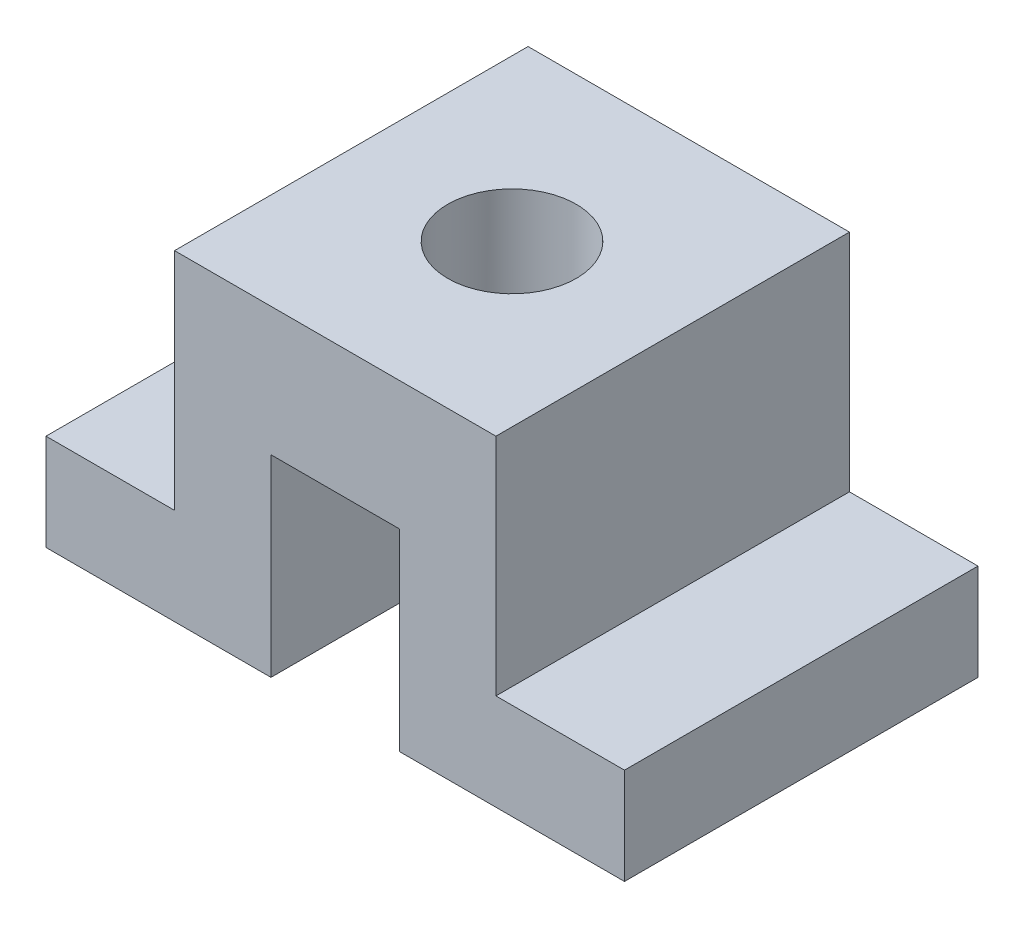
SolidWorks part; units mm, degrees
ref_plane "前视基准面" through (0, 0, 0) normal (0, 0, 1) x (1, 0, 0)
ref_plane "上视基准面" through (0, 0, 0) normal (0, 1, 0) x (1, 0, 0)
ref_plane "右视基准面" through (0, 0, 0) normal (1, 0, 0) x (0, 0, -1)
sketch "草图1" plane through (0, 0, 0) normal (0, 1, 0) x (1, 0, 0)
  line L1 (0, 0) -> (90, 0)
  line L2 (0, 0) -> (0, 55)
  line L3 (0, 55) -> (90, 55)
  line L4 (90, 0) -> (90, 55)
  dimension "D1" = 90
  dimension "D2" = 55
extrude "拉伸1" add sketch "草图1" along normal blind 50
sketch "草图3" plane through (0, 0, 0) normal (0, 0, 1) x (1, 0, 0)
  line L0 (0, 0) -> (90, 0) construction
  line L1 (0, 50) -> (20, 50)
  line L2 (0, 50) -> (0, 15)
  line L3 (0, 15) -> (20, 15)
  line L4 (20, 50) -> (20, 15)
  line L5 (90, 50) -> (70, 50)
  line L6 (90, 50) -> (90, 15)
  line L7 (90, 15) -> (70, 15)
  line L8 (70, 50) -> (70, 15)
  line L9 (35, 0) -> (55, 0)
  line L10 (35, 0) -> (35, 30)
  line L11 (35, 30) -> (55, 30)
  line L12 (55, 0) -> (55, 30)
  line L13 (45, 0) -> (45, -11.1635) construction
  dimension "D1" = 20
  dimension "D2" = 20
  dimension "D3" = 30
  dimension "D4" = 20
  dimension "D5" = 15
extrude "切除-拉伸1" cut sketch "草图3" against normal through all
sketch "草图4" plane through (0, 50, 0) normal (0, 1, 0) x (1, 0, 0)
  line L0 (20, 27.5) -> (56.2069, 27.5) construction
  line L1 (20, 55) -> (20, 0) construction
  line L2 (45, 55) -> (45, 18.8793) construction
  line L3 (70, 55) -> (20, 55) construction
  circle A0 centre (45, 27.5) radius 10
  dimension "D1" = 20
extrude "切除-拉伸2" cut sketch "草图4" against normal through all
